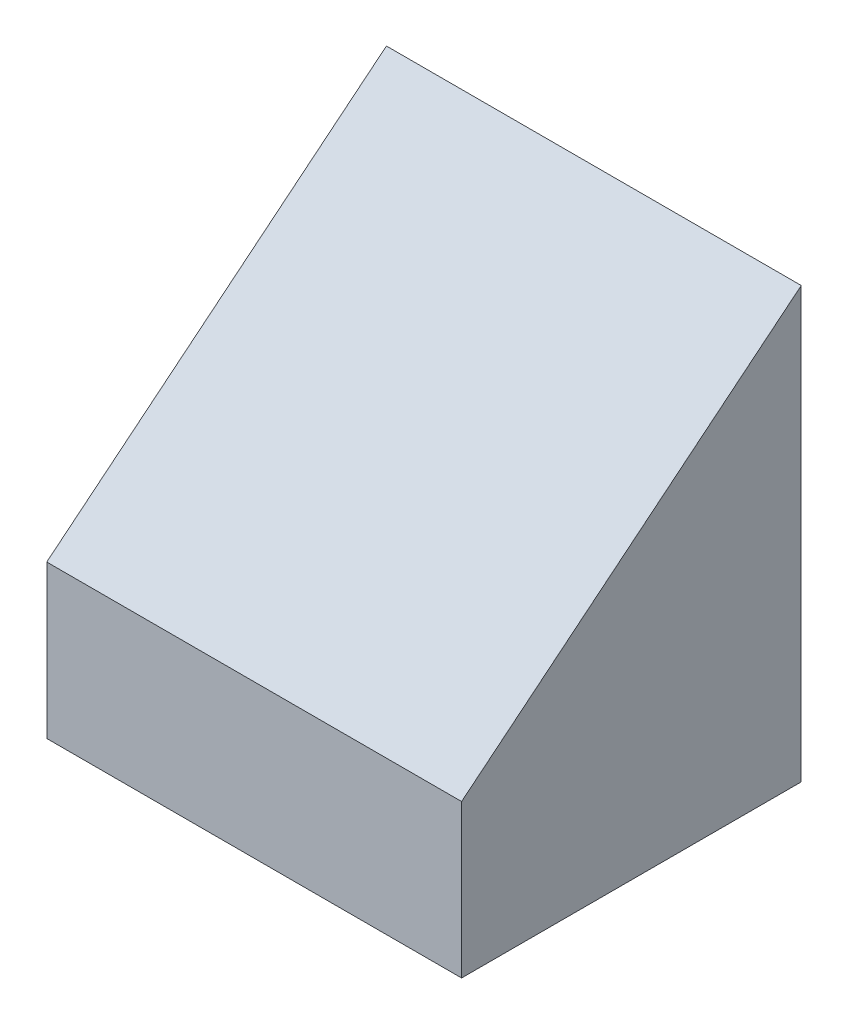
SolidWorks part; units mm, degrees
ref_plane "Front Plane" through (0, 0, 0) normal (0, 0, 1) x (1, 0, 0)
ref_plane "Top Plane" through (0, 0, 0) normal (0, 1, 0) x (1, 0, 0)
ref_plane "Right Plane" through (0, 0, 0) normal (1, 0, 0) x (0, 0, -1)
sketch "Sketch1" plane through (0, 0, 0) normal (1, 0, 0) x (0, 0, -1)
  line L0 (0, 0) -> (152.2364, 0)
  line L1 (152.2364, 0) -> (152.2364, 192.6776)
  line L2 (152.2364, 192.6776) -> (0, 68.5013)
  line L3 (0, 68.5013) -> (0, 0)
extrude "Extrude1" add sketch "Sketch1" along normal mid plane 185.928
